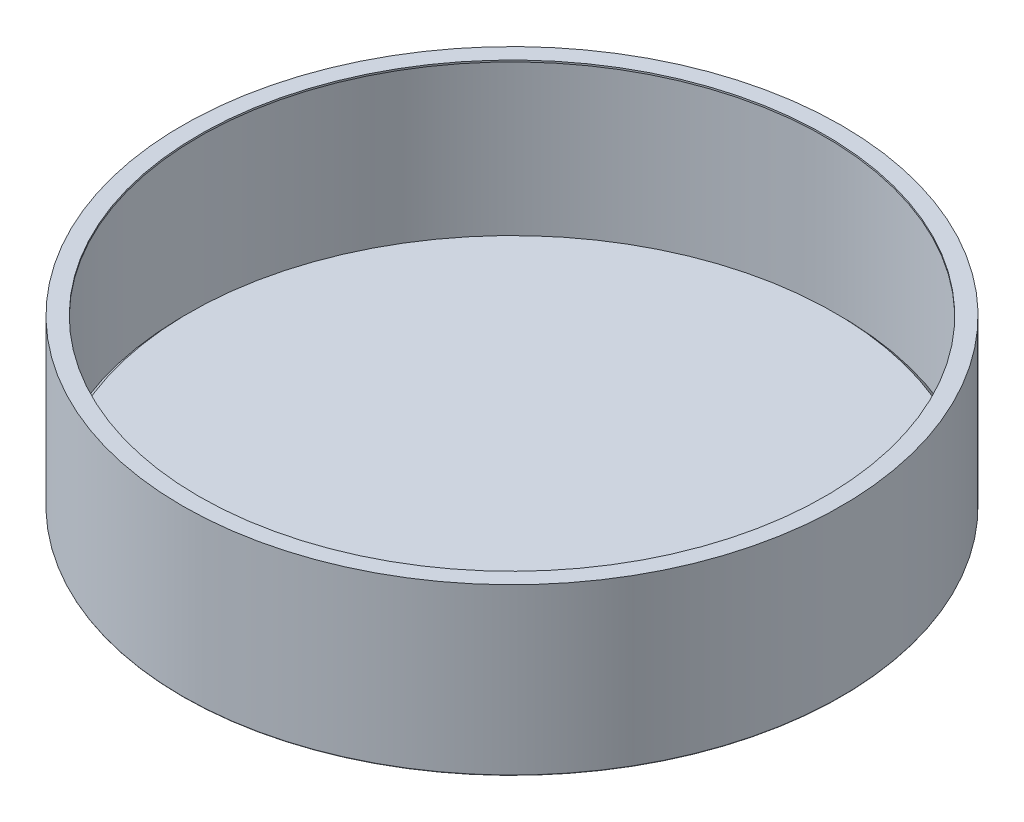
SolidWorks part; units mm, degrees
ref_plane "Alzado" through (0, 0, 0) normal (0, 0, 1) x (1, 0, 0)
ref_plane "Planta" through (0, 0, 0) normal (0, 1, 0) x (1, 0, 0)
ref_plane "Vista lateral" through (0, 0, 0) normal (1, 0, 0) x (0, 0, -1)
sketch "Croquis1" plane through (0, 0, 0) normal (0, 0, 1) x (1, 0, 0)
  line L0 (0, 96.1469) -> (0, 94.9438) construction
  line L1 (0, 0) -> (-195.9757, 0)
  line L7 (-200.0308, 97.4734) -> (-200.0308, -2.501)
  line L9 (-199.5308, -3.001) -> (-199.2501, -3.001)
  line L10 (-198.9006, -2.8586) -> (-195.9757, 0)
  line L11 (-198.9867, 96.4734) -> (-198.9867, -2.0188)
  line L13 (-198.9867, -2.0188) -> (-195.9757, 1)
  line L14 (-190.0308, 97.4734) -> (-200.0308, 97.4734)
  line L17 (-195.9757, 1) -> (0, 1)
  line L19 (-198.9867, 96.4734) -> (-190.0308, 96.4734)
  line L20 (0, 1) -> (0, 0)
  line L21 (-190.0308, 97.4734) -> (-190.0308, 96.4734)
  arc A0 (-200.0308, -2.501) -> (-199.5308, -3.001) centre (-199.5308, -2.501) ccw
  arc A1 (-198.9006, -2.8586) -> (-199.2501, -3.001) centre (-199.2501, -2.501) cw
  dimension "D1" = 0.5
  dimension "D2" = 0.5
  dimension "D5" = 135.657
  dimension "D6" = 4.001
  dimension "D7" = 99.9745
  dimension "D8" = 4.0551
  dimension "D9" = 1.1302
  dimension "D10" = 1
revolve "Revolución4" add sketch "Croquis1" angle 360 about L0
sketch "Croquis2" plane through (0, 0, 0) normal (0, -1, 0) x (1, 0, 0)
  line L0 (0, 216.5507) -> (0, -238.5872) construction
  line L1 (-237.7397, 0) -> (224.1788, 0) construction
  circle A0 centre (0, 0) radius 100 construction
  dimension "D1" = 200
sketch "Croquis3" plane through (0, 0, 0) normal (0, 0, 1) x (1, 0, 0)
  line L0 (-106, 0) -> (-100, 0)
  line L1 (-237.7397, 0) -> (224.1788, 0) construction
  line L2 (-100, 0) -> (100, 0) construction
  line L6 (-100, -2) -> (-103, -2)
  line L10 (-106, 0) -> (-103, -2)
  line L11 (-100, -2) -> (-100, 0)
  line L12 (-100, -6.076) -> (-100, -13.8451) construction
revolve "Revolución5" add sketch "Croquis3" angle 360 about L12
pattern_circular "MatrizC1" count 4 over 360 about axis through (0.0938, 0, 0) along (0, 1, 0) of "Revolución5"
